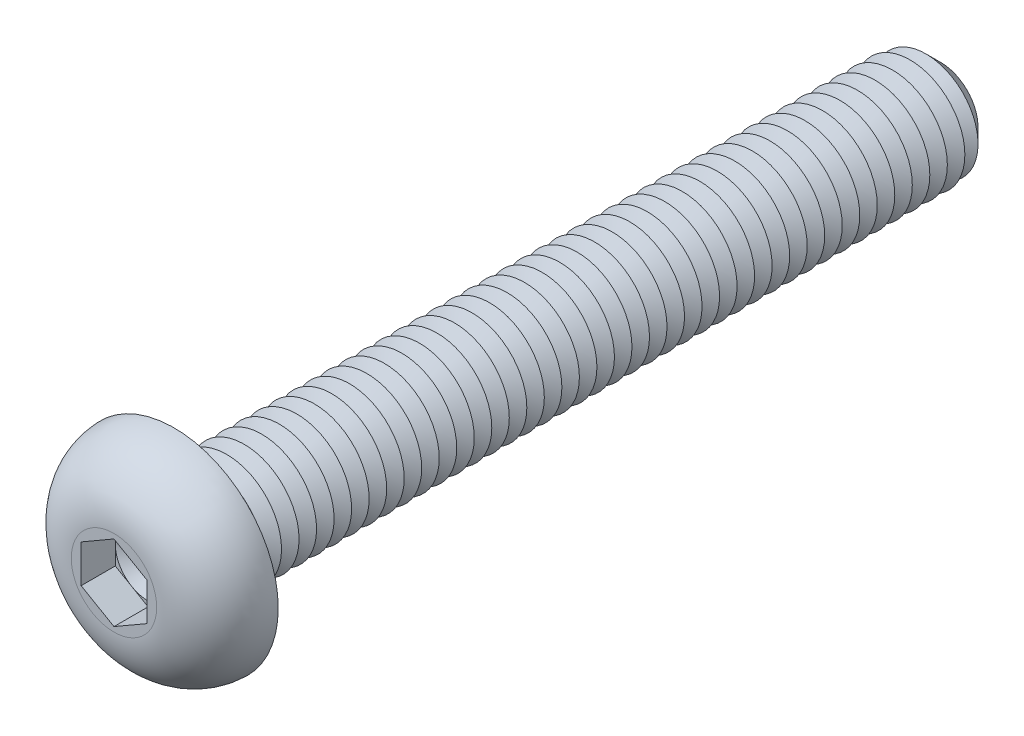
SolidWorks part; units mm, degrees
ref_plane "Front Plane" through (0, 0, 0) normal (0, 0, 1) x (1, 0, 0)
ref_plane "Top Plane" through (0, 0, 0) normal (0, 1, 0) x (1, 0, 0)
ref_plane "Right Plane" through (0, 0, 0) normal (1, 0, 0) x (0, 0, -1)
sketch "Sketch1" plane through (0, 0, 0) normal (1, 0, 0) x (0, 0, -1)
  line L0 (-47.9342, 0) -> (60.3146, 0) construction
sketch "Sketch2" plane through (0, 0, 0) normal (1, 0, 0) x (0, 0, -1)
  line L0 (0, 0) -> (-2.75, 0)
  line L1 (-47.9342, 0) -> (60.3146, 0) construction
  line L2 (-2.75, 0) -> (-2.75, 1.9504)
  line L3 (0, 4.75) -> (0, 0)
  arc A0 (-2.75, 1.9504) -> (0, 4.75) centre (0.05, 1.9504) cw
  dimension "D1" = 2.8
  dimension "D2" = 2.75
  dimension "D3" = 4.75
revolve "Revolve1" add sketch "Sketch2" angle 360 about L0
sketch "Sketch3" plane through (0, 0, 2.75) normal (0, 0, 1) x (1, 0, 0)
  line L1 (0, 1.7321) -> (-1.5, 0.866)
  line L2 (-1.5, 0.866) -> (-1.5, -0.866)
  line L3 (-1.5, -0.866) -> (0, -1.7321)
  line L4 (0, -1.7321) -> (1.5, -0.866)
  line L5 (1.5, -0.866) -> (1.5, 0.866)
  line L6 (1.5, 0.866) -> (0, 1.7321)
  circle A0 centre (0, 0) radius 1.5 construction
  dimension "D1" = 3
extrude "Cut-Extrude1" cut sketch "Sketch3" against normal blind 1.56
sketch "Sketch4" plane through (0, 0, 0) normal (0, 0, -1) x (-1, 0, 0)
  circle A0 centre (0, 0) radius 2.5
  dimension "D1" = 5
extrude "Boss-Extrude1" add sketch "Sketch4" along normal blind 35
chamfer "Chamfer1" distance 0.8 angle 45 1 edges at (-2.5, 0, -35)
sketch "Sketch5" plane through (0, 0, 0) normal (1, 0, 0) x (0, 0, -1)
  line L0 (0.8, 2.5) -> (1.6, 2.5)
  line L1 (34.2, 2.5) -> (0, 2.5) construction
  line L2 (1.6, 2.5) -> (1.2, 1.8072)
  line L3 (1.2, 1.8072) -> (0.8, 2.5)
  line L4 (0, -4.75) -> (0, 4.75) construction
  line L5 (34.2, 2.5) -> (0, 2.5) construction
  dimension "D1" = 0.8
  dimension "D2" = 0.8
revolve "Cut-Revolve1" cut sketch "Sketch5" angle 360 about L0
pattern_linear "LPattern1" count 42 spacing 0.8 along (0, 0, -1) of "Cut-Revolve1"
fillet "Fillet2" radius 0.4 1 edges at (2.5, 0, 0)
sketch "Sketch6" plane through (0, 0, 1.19) normal (0, 0, 1) x (1, 0, 0)
  line L0 (0, -1.7321) -> (1.5, -0.866) construction
  circle A0 centre (0, 0) radius 1.5
extrude "Cut-Extrude2" cut sketch "Sketch6" against normal through all draft 60
